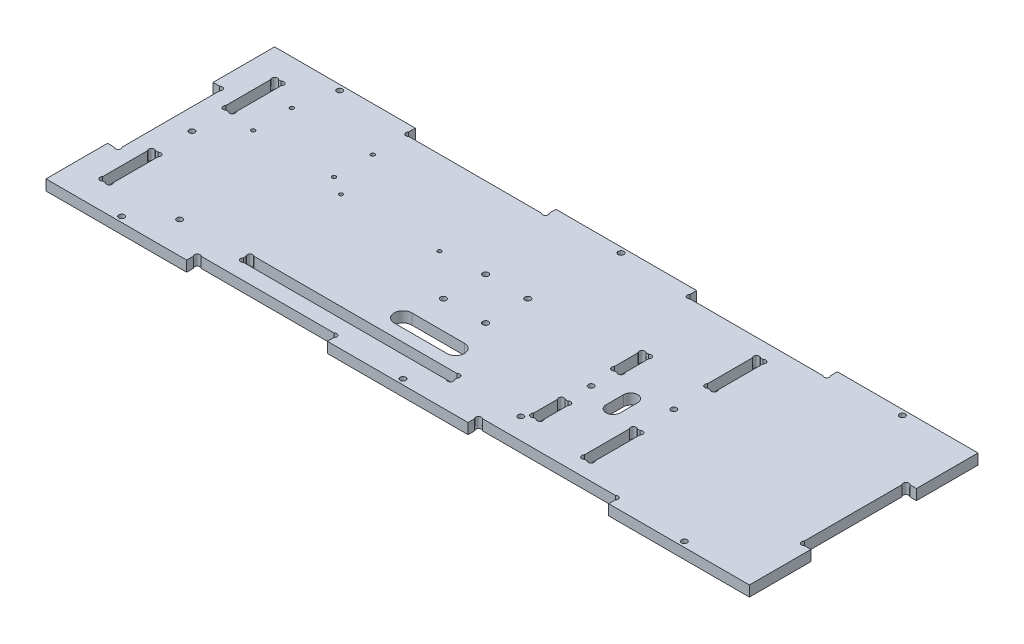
SolidWorks part; units mm, degrees
ref_plane "Plan de face" through (0, 0, 0) normal (0, 0, 1) x (1, 0, 0)
ref_plane "Plan de dessus" through (0, 0, 0) normal (0, 1, 0) x (1, 0, 0)
ref_plane "Plan de droite" through (0, 0, 0) normal (1, 0, 0) x (0, 0, -1)
sketch "Esquisse1" plane through (0, 0, 0) normal (0, 1, 0) x (1, 0, 0)
  line L0 (242.6104, 0) -> (-73.75, 0) construction
  line L1 (0, -25.162) -> (0, 118.5803) construction
  line L2 (242.6104, 65) -> (-208.8742, 65) construction
  line L3 (-200, 65) -> (-120, 65)
  line L4 (-200, 65) -> (-200, 30)
  line L5 (-200, -65) -> (-120, -65)
  line L6 (200, 65) -> (200, 30)
  line L7 (-200, 65) -> (200, -65) construction
  line L8 (-200, -65) -> (200, 65) construction
  line L9 (242.6104, -65) -> (-208.8742, -65) construction
  line L10 (200, 118.5803) -> (200, -91.0152) construction
  line L11 (-200, 85.718) -> (-200, -91.0152) construction
  line L12 (218.5247, 59) -> (-63.5463, 59) construction
  line L13 (40, 93.508) -> (40, 40.2932) construction
  line L14 (80, 104.1019) -> (80, 60.3095) construction
  line L15 (40, 59) -> (69.5742, 88.5742) construction
  line L16 (40, 65) -> (40, 61.2627)
  line L17 (120, 65) -> (120, 61.2627)
  line L18 (42.2627, 59) -> (117.7373, 59)
  line L19 (120, 65) -> (200, 65)
  line L20 (194, 58.3419) -> (194, -17.0938) construction
  line L21 (189.4171, 30) -> (218.5247, 30) construction
  line L22 (194, 30) -> (209.2061, 14.7939) construction
  line L23 (196.2627, 30) -> (200, 30)
  line L24 (196.2627, -30) -> (200, -30)
  line L25 (194, -27.7373) -> (194, 27.7373)
  line L26 (200, -30) -> (200, -65)
  line L27 (120, -65) -> (120, -61.2627)
  line L28 (42.2627, -59) -> (117.7373, -59)
  line L29 (40, -65) -> (40, -61.2627)
  line L30 (120, -65) -> (200, -65)
  line L31 (-194, -27.7373) -> (-194, 27.7373)
  line L32 (-196.2627, -30) -> (-200, -30)
  line L33 (-196.2627, 30) -> (-200, 30)
  line L34 (-40, -65) -> (-40, -61.2627)
  line L35 (-42.2627, -59) -> (-117.7373, -59)
  line L36 (-120, -65) -> (-120, -61.2627)
  line L37 (-42.2627, 59) -> (-117.7373, 59)
  line L38 (-120, 65) -> (-120, 61.2627)
  line L39 (-40, 65) -> (-40, 61.2627)
  line L40 (-40, -65) -> (40, -65)
  line L41 (-40, 65) -> (40, 65)
  line L42 (-200, -30) -> (-200, -65)
  line L43 (-31.259, 62) -> (4.3633, 62) construction
  line L44 (95, 52.5812) -> (95, -91.0152) construction
  line L45 (89, -78.9937) -> (89, 52.5812) construction
  line L46 (-45, -78.9937) -> (-45, 52.5812) construction
  line L47 (-185, -91.0152) -> (-185, 60.125) construction
  line L48 (112.1173, 50) -> (-194, 50) construction
  line L49 (17.8725, -44) -> (77.7271, -44) construction
  line L50 (112.1173, 35) -> (82.7925, 35) construction
  line L51 (60, -72.6865) -> (60, 23.3646) construction
  line L52 (54, -72.6865) -> (54, -13.7964) construction
  line L53 (57, -61.2627) -> (57, 3.7824) construction
  line L54 (89, 50) -> (98.8977, 40.1023) construction
  line L55 (91.2627, 50) -> (92.7373, 50)
  line L56 (91.2627, 20) -> (92.7373, 20)
  line L57 (89, 22.2627) -> (89, 47.7373)
  line L58 (19.7523, 13) -> (-25.7753, 13) construction
  line L59 (95, 47.7373) -> (95, 22.2627)
  line L60 (95, -47.7373) -> (95, -22.2627)
  line L61 (19.7523, -11) -> (-25.7753, -11) construction
  line L62 (92, 40.2932) -> (92, -10.6796) construction
  line L63 (46.7766, -35) -> (62.2431, -35) construction
  line L64 (89, -22.2627) -> (89, -47.7373)
  line L65 (91.2627, -20) -> (92.7373, -20)
  line L66 (91.2627, -50) -> (92.7373, -50)
  line L67 (-181.2627, -50) -> (-182.7373, -50)
  line L68 (-181.2627, -20) -> (-182.7373, -20)
  line L69 (-179, -22.2627) -> (-179, -47.7373)
  line L70 (-28, -13.1057) -> (-28, 28.8) construction
  line L71 (-185, -47.7373) -> (-185, -22.2627)
  line L72 (-185, 47.7373) -> (-185, 22.2627)
  line L73 (-4, -13.1057) -> (-4, 26.9157) construction
  line L74 (-179, 22.2627) -> (-179, 47.7373)
  line L75 (-181.2627, 20) -> (-182.7373, 20)
  line L76 (-181.2627, 50) -> (-182.7373, 50)
  line L77 (36.9231, -12) -> (80, -12) construction
  line L78 (54, -44) -> (69.9788, -28.0212) construction
  line L79 (56.2627, -26) -> (57.7373, -26)
  line L80 (54, -28.2627) -> (54, -41.7373)
  line L81 (-102.7373, -44) -> (12.7373, -44)
  line L82 (-102.7373, -50) -> (12.7373, -50)
  line L83 (-105, -47.7373) -> (-105, -46.2627)
  line L84 (15, -47.7373) -> (15, -46.2627)
  line L85 (56.2627, -44) -> (57.7373, -44)
  line L86 (60, -28.2627) -> (60, -41.7373)
  line L87 (60, 4.2627) -> (60, 17.7373)
  line L88 (56.2627, 20) -> (57.7373, 20)
  line L89 (54, 4.2627) -> (54, 17.7373)
  line L90 (56.2627, 2) -> (57.7373, 2)
  line L91 (28.112, -32) -> (-50.6939, -32) construction
  line L92 (0, -18.3983) -> (0, -40.8217) construction
  line L93 (-30, -18.3983) -> (-30, -41.7373) construction
  line L94 (-30, -27) -> (0, -27)
  line L95 (-30, -37) -> (0, -37)
  line L96 (74.5, 10.205) -> (74.5, -22.9588) construction
  line L97 (80, -7) -> (64.2856, -7) construction
  line L98 (70.5, -7) -> (70.5, -17)
  line L99 (78.5, -7) -> (78.5, -17)
  line L100 (-169, 60.125) -> (-169, 10.205) construction
  line L101 (-176.1306, 43.8) -> (-102.7373, 43.8) construction
  line L102 (-179, 60.125) -> (-179, 10.205) construction
  line L103 (-165, 60.125) -> (-165, 35) construction
  line L104 (-176.1306, 39.8) -> (-114.3525, 39.8) construction
  line L105 (-176.1306, 28.8) -> (-156.0001, 28.8) construction
  line L106 (-119, 58.3419) -> (-119, 35) construction
  arc A0 (40, 61.2627) -> (42.2627, 59) centre (41.1314, 60.1314) ccw
  arc A1 (120, 61.2627) -> (117.7373, 59) centre (118.8686, 60.1314) cw
  arc A2 (196.2627, 30) -> (194, 27.7373) centre (195.1314, 28.8686) ccw
  arc A3 (196.2627, -30) -> (194, -27.7373) centre (195.1314, -28.8686) cw
  arc A4 (120, -61.2627) -> (117.7373, -59) centre (118.8686, -60.1314) ccw
  arc A5 (40, -61.2627) -> (42.2627, -59) centre (41.1314, -60.1314) cw
  arc A6 (-196.2627, -30) -> (-194, -27.7373) centre (-195.1314, -28.8686) ccw
  arc A7 (-196.2627, 30) -> (-194, 27.7373) centre (-195.1314, 28.8686) cw
  arc A8 (-40, -61.2627) -> (-42.2627, -59) centre (-41.1314, -60.1314) ccw
  arc A9 (-120, -61.2627) -> (-117.7373, -59) centre (-118.8686, -60.1314) cw
  arc A10 (-120, 61.2627) -> (-117.7373, 59) centre (-118.8686, 60.1314) ccw
  arc A11 (-40, 61.2627) -> (-42.2627, 59) centre (-41.1314, 60.1314) cw
  circle A12 centre (0, 62) radius 1.6
  circle A13 centre (160, 62) radius 1.6
  circle A14 centre (-160, 62) radius 1.6
  circle A15 centre (0, -62) radius 1.6
  circle A16 centre (160, -62) radius 1.6
  circle A17 centre (-160, -62) radius 1.6
  arc A18 (91.2627, 50) -> (89, 47.7373) centre (90.1314, 48.8686) ccw
  arc A19 (92.7373, 50) -> (95, 47.7373) centre (93.8686, 48.8686) cw
  arc A20 (91.2627, 20) -> (89, 22.2627) centre (90.1314, 21.1314) cw
  arc A21 (92.7373, 20) -> (95, 22.2627) centre (93.8686, 21.1314) ccw
  arc A22 (92.7373, -20) -> (95, -22.2627) centre (93.8686, -21.1314) cw
  arc A23 (91.2627, -20) -> (89, -22.2627) centre (90.1314, -21.1314) ccw
  arc A24 (92.7373, -50) -> (95, -47.7373) centre (93.8686, -48.8686) ccw
  arc A25 (91.2627, -50) -> (89, -47.7373) centre (90.1314, -48.8686) cw
  arc A26 (54, -41.7373) -> (56.2627, -44) centre (55.1314, -42.8686) ccw
  circle A27 centre (92, 0) radius 1.6
  circle A28 centre (-182, 0) radius 1.6
  arc A29 (-181.2627, -50) -> (-179, -47.7373) centre (-180.1314, -48.8686) ccw
  arc A30 (-182.7373, -50) -> (-185, -47.7373) centre (-183.8686, -48.8686) cw
  arc A31 (-181.2627, -20) -> (-179, -22.2627) centre (-180.1314, -21.1314) cw
  arc A32 (-182.7373, -20) -> (-185, -22.2627) centre (-183.8686, -21.1314) ccw
  arc A33 (-182.7373, 20) -> (-185, 22.2627) centre (-183.8686, 21.1314) cw
  arc A34 (-181.2627, 20) -> (-179, 22.2627) centre (-180.1314, 21.1314) ccw
  arc A35 (-182.7373, 50) -> (-185, 47.7373) centre (-183.8686, 48.8686) ccw
  arc A36 (-181.2627, 50) -> (-179, 47.7373) centre (-180.1314, 48.8686) cw
  arc A37 (60, -41.7373) -> (57.7373, -44) centre (58.8686, -42.8686) cw
  arc A38 (54, -28.2627) -> (56.2627, -26) centre (55.1314, -27.1314) cw
  arc A39 (60, -28.2627) -> (57.7373, -26) centre (58.8686, -27.1314) ccw
  arc A40 (60, 4.2627) -> (57.7373, 2) centre (58.8686, 3.1314) cw
  arc A41 (54, 4.2627) -> (56.2627, 2) centre (55.1314, 3.1314) ccw
  circle A42 centre (-142, -47) radius 1.6
  arc A43 (-102.7373, -44) -> (-105, -46.2627) centre (-103.8686, -45.1314) ccw
  arc A44 (-102.7373, -50) -> (-105, -47.7373) centre (-103.8686, -48.8686) cw
  arc A45 (12.7373, -50) -> (15, -47.7373) centre (13.8686, -48.8686) ccw
  arc A46 (12.7373, -44) -> (15, -46.2627) centre (13.8686, -45.1314) cw
  circle A47 centre (52, -47) radius 1.6
  circle A48 centre (-28, -11) radius 1.65
  circle A49 centre (-28, 13) radius 1.65
  circle A50 centre (-4, 13) radius 1.65
  circle A51 centre (-4, -11) radius 1.65
  arc A52 (60, 17.7373) -> (57.7373, 20) centre (58.8686, 18.8686) ccw
  arc A53 (54, 17.7373) -> (56.2627, 20) centre (55.1314, 18.8686) cw
  circle A54 centre (57, -12) radius 1.6
  arc A55 (-30, -27) -> (-30, -37) centre (-30, -32) ccw
  arc A56 (0, -37) -> (0, -27) centre (0, -32) ccw
  arc A57 (78.5, -7) -> (70.5, -7) centre (74.5, -7) ccw
  arc A58 (78.5, -17) -> (70.5, -17) centre (74.5, -17) cw
  circle A59 centre (-165, 39.8) radius 1.1
  circle A60 centre (-119, 39.8) radius 1.1
  circle A61 centre (-165, 17.8) radius 1.1
  circle A62 centre (-119, 17.8) radius 1.1
  circle A63 centre (-52.5, 11.2562) radius 1.1
  circle A64 centre (-108.5, 11.2562) radius 1.1
  point P5 (0, 0)
  dimension "D7" = 6
  dimension "D10" = 3
  dimension "D11" = 6
  dimension "D21" = 3
  dimension "D23" = 32
  dimension "D26" = 17
  dimension "D27" = 11
  dimension "D16" = 140
  dimension "D24" = 24
  dimension "D29" = 12
  dimension "D32" = 14.5
  dimension "D34" = 6.2
  dimension "D1" = 65
  dimension "D2" = 200
  dimension "D3" = 80
  dimension "D4" = 40
  dimension "D5" = 6
  dimension "D6" = 45
  dimension "D8" = 30
  dimension "D9" = 45
  dimension "D12" = 9
  dimension "D13" = 280
  dimension "D14" = 15
  dimension "D15" = 3
  dimension "D17" = 6
  dimension "D18" = 45
  dimension "D19" = 29
  dimension "D20" = 9
  dimension "D22" = 15
  dimension "D25" = 24
  dimension "D28" = 45
  dimension "D30" = 15
  dimension "D31" = 30
  dimension "D33" = 5
  dimension "D35" = 10
  dimension "D36" = 4
  dimension "D37" = 11
  dimension "D38" = 4
  dimension "D39" = 46
extrude "Boss.-Extru.1" add sketch "Esquisse1" along normal blind 6
sketch "Esquisse2" plane through (0, 0, 0) normal (0, -1, 0) x (1, 0, 0)
  line L0 (86.1365, 0) -> (181.7966, 0) construction
  line L1 (100, -7.6546) -> (100, 47.6067) construction
  line L2 (97.5798, 27) -> (163.8163, 27) construction
  line L3 (146, 47.6067) -> (146, -7.6546) construction
  line L4 (97.5798, 5) -> (163.8163, 5) construction
  line L5 (156.189, 16) -> (119.4014, 16) construction
  line L6 (123, 0.066) -> (123, 39.1305) construction
  line L7 (95, 47.7373) -> (95, 22.2627) construction
  line L8 (0, 99.4569) -> (0, -34.0816) construction
  circle A0 centre (146, 27) radius 1.1
  circle A1 centre (146, 5) radius 1.1
  circle A2 centre (100, 5) radius 1.1
  circle A3 centre (100, 27) radius 1.1
  circle A4 centre (100, -5) radius 1.1
  circle A5 centre (146, -5) radius 1.1
  circle A6 centre (146, -27) radius 1.1
  circle A7 centre (100, -27) radius 1.1
  circle A8 centre (-146, 5) radius 1.1
  circle A9 centre (-100, 5) radius 1.1
  circle A10 centre (-100, 27) radius 1.1
  circle A11 centre (-146, 27) radius 1.1
  dimension "D1" = 22
  dimension "D2" = 46
  dimension "D3" = 11
  dimension "D4" = 23
  dimension "D5" = 5
  dimension "D6" = 5
extrude "Enlèv. mat.-Extru.1" cut sketch "Esquisse2" against normal blind 1
